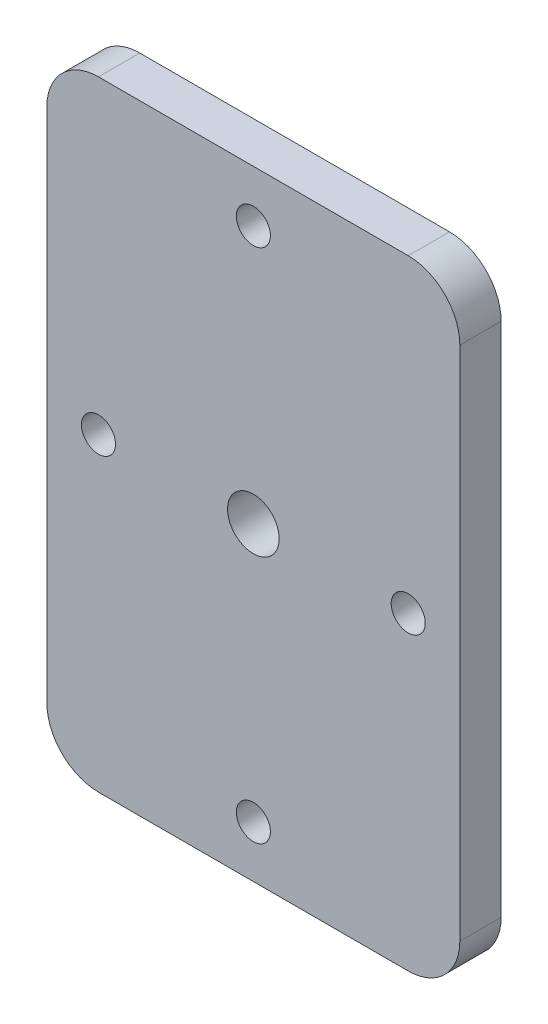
SolidWorks part; units mm, degrees
ref_plane "前视基准面" through (0, 0, 0) normal (0, 0, 1) x (1, 0, 0)
ref_plane "上视基准面" through (0, 0, 0) normal (0, 1, 0) x (1, 0, 0)
ref_plane "右视基准面" through (0, 0, 0) normal (1, 0, 0) x (0, 0, -1)
sketch "草图1" plane through (0, 0, 0) normal (0, 0, 1) x (1, 0, 0)
  line L0 (45, -25) -> (45, 25) construction
  line L1 (10, -30) -> (40, -30) construction
  line L2 (5, 25) -> (5, -25) construction
  line L3 (40, 30) -> (10, 30) construction
  line L4 (45, -25) -> (45, 25)
  line L5 (10, -30) -> (40, -30)
  line L6 (5, 25) -> (5, -25)
  line L7 (40, 30) -> (10, 30)
  arc A0 (45, 25) -> (40, 30) centre (40, 25) ccw construction
  arc A1 (40, -30) -> (45, -25) centre (40, -25) ccw construction
  arc A2 (5, -25) -> (10, -30) centre (10, -25) ccw construction
  arc A3 (10, 30) -> (5, 25) centre (10, 25) ccw construction
  arc A4 (45, 25) -> (40, 30) centre (40, 25) ccw
  arc A5 (40, -30) -> (45, -25) centre (40, -25) ccw
  arc A6 (5, -25) -> (10, -30) centre (10, -25) ccw
  arc A7 (10, 30) -> (5, 25) centre (10, 25) ccw
extrude "拉伸1" add sketch "草图1" along normal blind 4
hole_wizard "M4 螺纹孔1" positions "草图3" profile "草图2" tap size "M4" standard "ISO"
sketch "草图3" plane through (0, 0, 4) normal (0, 0, 1) x (1, 0, 0)
  point P1 (40, 0)
  point P4 (25, 25)
  point P7 (25, -25)
  point P10 (10, 0)
sketch "草图2" plane through (40, 0, 4) normal (1, 0, 0) x (0, -1, 0)
  line L0 (0, 0) -> (0, 4)
  line L1 (0, 4) -> (1.65, 4)
  line L2 (1.65, 4) -> (1.65, 0)
  line L5 (1.65, 0) -> (0, 0)
  line L11 (0, -6.35) -> (0, 107.95) construction
  dimension "籵謂蹟恇謂郰芛眻噤" = 3.3
  dimension "籵謂蹟恇謂郰芛旮僅" = 4
sketch "草图5" plane through (0, 0, 4) normal (0, 0, 1) x (1, 0, 0)
  point P0 (25, 0)
hole_wizard "M6 螺纹孔1" positions "3D草图1" profile "草图6" tap size "M6" standard "ISO"
sketch3d "3D草图1"
  point P0 (25, 0, 4)
sketch "草图6" plane through (25, 0, 4) normal (1, 0, 0) x (0, -1, 0)
  line L0 (0, 0) -> (0, 4)
  line L1 (0, 4) -> (2.5, 4)
  line L2 (2.5, 4) -> (2.5, 0)
  line L5 (2.5, 0) -> (0, 0)
  line L11 (0, -6.35) -> (0, 107.95) construction
  dimension "籵謂蹟恇謂郰芛眻噤" = 5
  dimension "籵謂蹟恇謂郰芛旮僅" = 4
